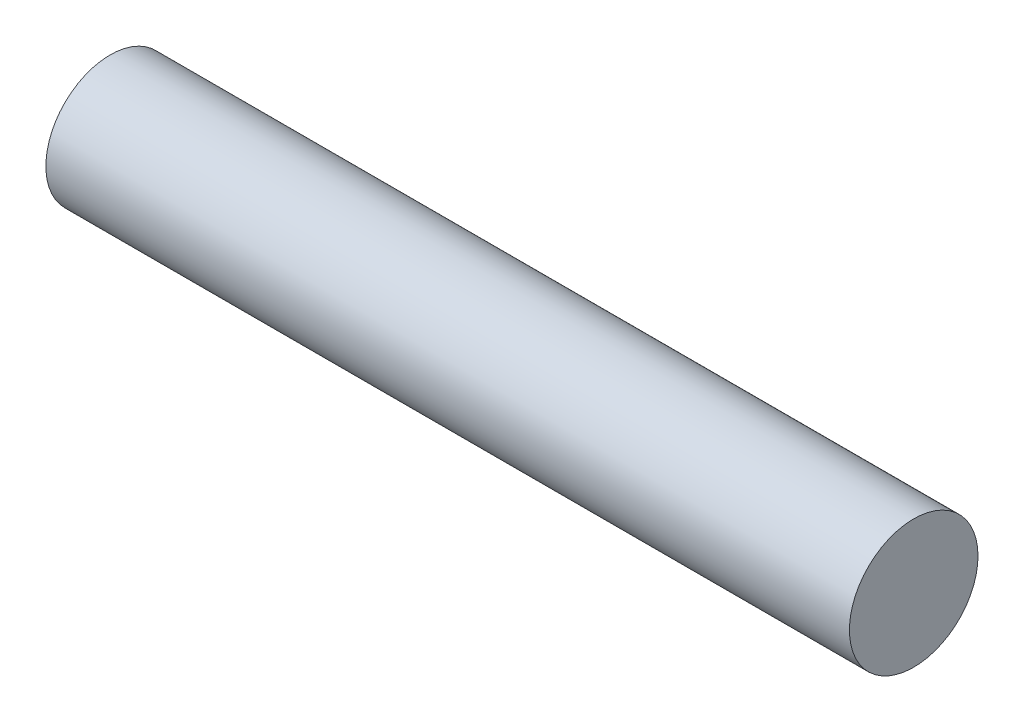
SolidWorks part; units mm, degrees
ref_plane "Front Plane" through (0, 0, 0) normal (1, 0, 0) x (0, 1, 0)
ref_plane "Top Plane" through (0, 0, 0) normal (0, 0, 1) x (0, 1, 0)
ref_plane "Right Plane" through (0, 0, 0) normal (0, 1, 0) x (-1, 0, 0)
sketch "Sketch1" plane through (0, 0, 0) normal (1, 0, 0) x (0, 1, 0)
  circle A0 centre (0, 0) radius 4
  dimension "D1" = 8
extrude "Boss-Extrude1" add sketch "Sketch1" along normal blind 50
